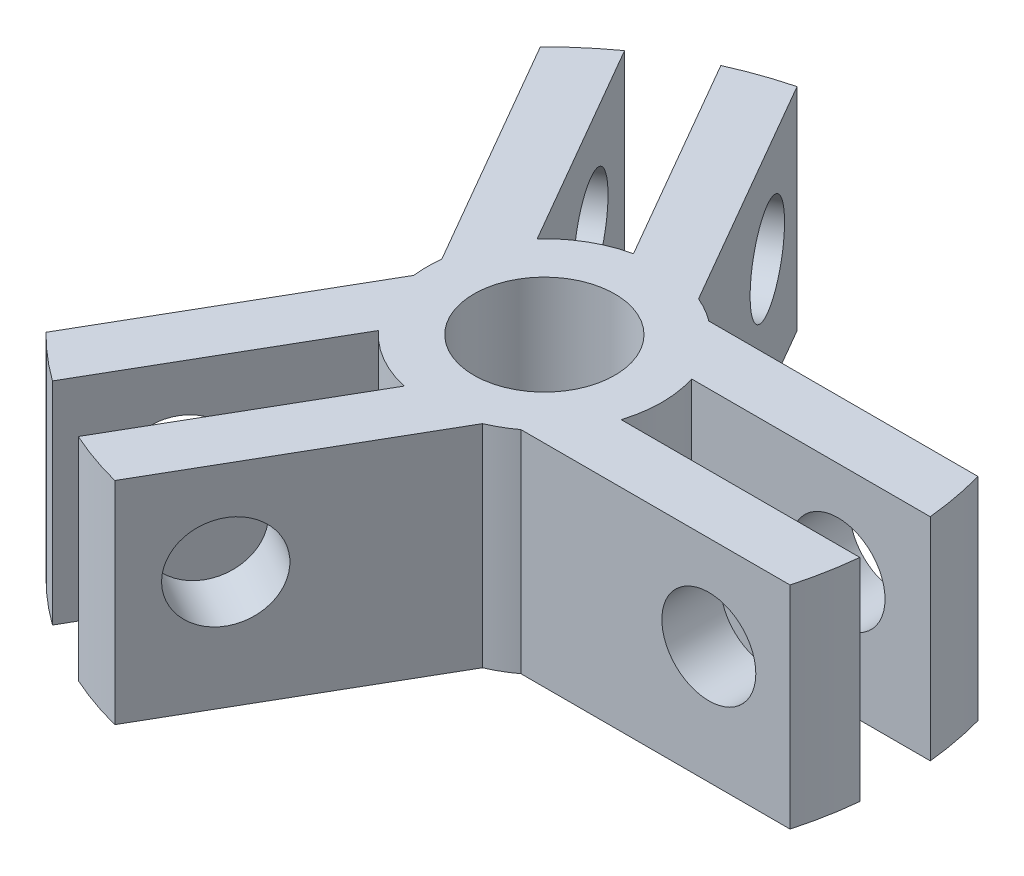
SolidWorks part; units mm, degrees
ref_plane "Front Plane" through (0, 0, 0) normal (0, 0, 1) x (1, 0, 0)
ref_plane "Top Plane" through (0, 0, 0) normal (0, 1, 0) x (1, 0, 0)
ref_plane "Right Plane" through (0, 0, 0) normal (1, 0, 0) x (0, 0, -1)
sketch "Sketch1" plane through (0, 0, 0) normal (0, 1, 0) x (1, 0, 0)
  circle A0 centre (0, 0) radius 30
  dimension "D1" = 60
extrude "Extrude1" add sketch "Sketch1" along normal blind 18
sketch "Sketch2" plane through (0, 18, 0) normal (0, 1, 0) x (-1, 0, 0)
  line L0 (36.4679, 0) -> (-36.4888, 0) construction
  line L1 (-29.8496, -3) -> (-9.5394, -3)
  line L4 (-9.5394, 3) -> (-29.8496, 3)
  arc A0 (-9.5394, -3) -> (-9.5394, 3) centre (0, 0) cw
  circle A1 centre (0, 0) radius 30 construction
  arc A2 (-29.8496, 3) -> (-29.8496, -3) centre (0, 0) ccw
  dimension "D2" = 20
  dimension "D1" = 6
hole_wizard "M12 Tapped Hole1" positions "Sketch21" profile "Sketch20" tap size "M12" standard "ISO"
sketch "Sketch21" plane through (0, 18, 0) normal (0, 1, 0) x (-1, 0, 0)
  point P0 (0, 0)
sketch "Sketch20" plane through (0, 18, 0) normal (1, 0, 0) x (0, 0, 1)
  line L0 (0, 0) -> (0, 18)
  line L1 (0, 18) -> (6, 18)
  line L2 (6, 18) -> (6, 0)
  line L5 (6, 0) -> (0, 0)
  line L11 (0, -6.35) -> (0, 107.95) construction
  dimension "Thread Major Dia." = 12
  dimension "Thru Tap Drill Depth" = 18
extrude "Cut-Extrude4" cut sketch "Sketch2" against normal through all
pattern_circular "CirPattern11" count 3 over 360 about axis through (0, 0, 0) along (0, 1, 0) of "Cut-Extrude4"
sketch "Sketch23" plane through (0, 18, 0) normal (0, 1, 0) x (-1, 0, 0)
  line L3 (-9.5394, 8) -> (-29.8496, 8)
  line L4 (-6, 8) -> (-28.9137, 8)
  line L6 (7.9966, 29.8505) -> (-2.1585, 12.2614)
  line L7 (7.5286, 29.04) -> (-3.9282, 9.1962)
  arc A0 (12.3267, 27.3505) -> (-29.8496, 3) centre (0, 0) ccw construction
  arc A1 (7.5286, 29.04) -> (-28.9137, 8) centre (0, 0) ccw
  arc A2 (-3.9282, 9.1962) -> (-6, 8) centre (0, 0) ccw
  arc A3 (-9.5394, 3) -> (-9.5394, -3) centre (0, 0) ccw construction
  dimension "D1" = 5
  dimension "D2" = 5
extrude "Cut-Extrude5" cut sketch "Sketch23" against normal through all
pattern_circular "CirPattern12" count 3 over 360 about axis through (0, 0, 0) along (0, 1, 0) of "Cut-Extrude5"
sketch "Sketch24" plane through (0, 0, 0) normal (0, 0, 1) x (1, 0, 0)
  line L0 (10, 18) -> (9.5394, 18) construction
  line L1 (0, 18) -> (0, 0) construction
  circle A0 centre (22, 10) radius 4
  dimension "D1" = 8
  dimension "D2" = 8
  dimension "D3" = 22
extrude "Cut-Extrude6" cut sketch "Sketch24" against normal through all and the other way through all
pattern_circular "CirPattern13" count 3 over 360 about axis through (0, 18, 0) along (0, -1, 0) of "Cut-Extrude6"
